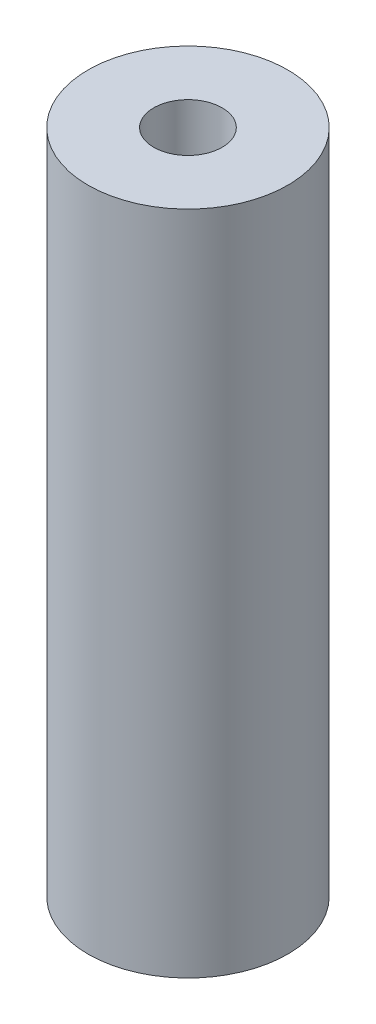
SolidWorks part; units mm, degrees
ref_plane "Front Plane" through (0, 0, 0) normal (0, 0, 1) x (1, 0, 0)
ref_plane "Top Plane" through (0, 0, 0) normal (0, 1, 0) x (1, 0, 0)
ref_plane "Right Plane" through (0, 0, 0) normal (1, 0, 0) x (0, 0, -1)
sketch "Sketch1" plane through (0, 0, 0) normal (0, 1, 0) x (1, 0, 0)
  circle A0 centre (0, 0) radius 3.2639
  circle A1 centre (0, 0) radius 9.525
  dimension "D1" = 19.05
  dimension "D2" = 6.5278
extrude "Boss-Extrude1" add sketch "Sketch1" along normal blind 63.5
